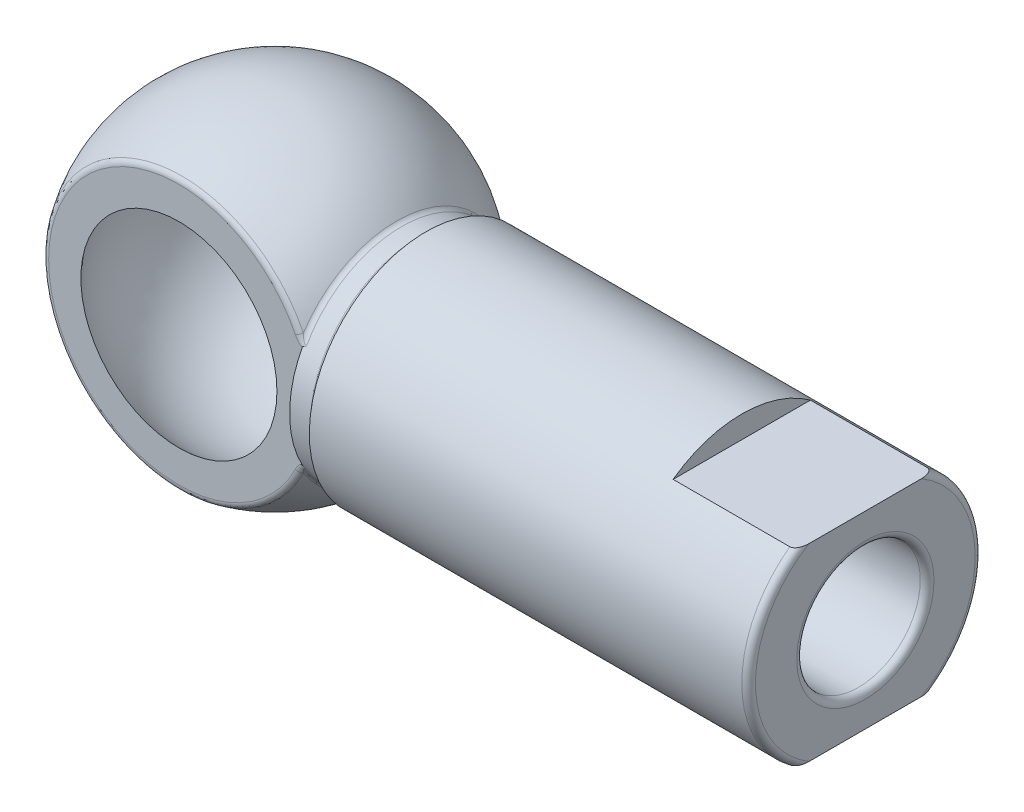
SolidWorks part; units mm, degrees
ref_plane "Plan de face" through (0, 0, 0) normal (0, 0, 1) x (1, 0, 0)
ref_plane "Plan de dessus" through (0, 0, 0) normal (0, 1, 0) x (1, 0, 0)
ref_plane "Plan de droite" through (0, 0, 0) normal (1, 0, 0) x (0, 0, -1)
sketch "Esquisse1" plane through (0, 0, 0) normal (0, 0, 1) x (1, 0, 0)
  line L0 (0, 0) -> (0, 12)
  line L1 (0, -55) -> (0, 55) construction
  arc A0 (0, 12) -> (0, 0) centre (0, 6) cw
  dimension "D1" = 12
revolve "Révolution1" add sketch "Esquisse1" angle 360 about L0
ref_plane "Plan1" through (0, 0, 3.5) normal (0, 0, 1) x (1, 0, 0)
sketch "Esquisse2" plane through (0, 0, 3.5) normal (0, 0, 1) x (1, 0, 0)
  circle A0 centre (0, 6) radius 5
  circle A1 centre (0, 6) radius 6 construction
  dimension "D1" = 10
extrude "Enlèv. mat.-Extru.1" cut sketch "Esquisse2" along normal through all
shell "Coque1" thickness 1
ref_plane "Plan2" through (4.5, 0, 0) normal (1, 0, 0) x (0, 0, -1)
sketch "Esquisse3" plane through (4.5, 0, 0) normal (1, 0, 0) x (0, 0, -1)
  circle A0 centre (0, 6) radius 4
  arc A1 (-3.5, 1.1266) -> (-3.5, 10.8734) centre (0, 6) ccw construction
  dimension "D1" = 8
extrude "Enlèv. mat.-Extru.2" cut sketch "Esquisse3" along normal through all
sketch "Esquisse4" plane through (4.5, 0, 0) normal (1, 0, 0) x (0, 0, -1)
  circle A0 centre (0, 6) radius 3.9686
  arc A1 (-3.5, 4.1292) -> (-3.5, 7.8708) centre (0, 6) ccw construction
extrude "Extrusion1" add sketch "Esquisse4" along normal blind 1
sketch "Esquisse5" plane through (5.5, 0, 0) normal (1, 0, 0) x (0, 0, -1)
  circle A0 centre (0, 6) radius 4.25
  circle A1 centre (0, 6) radius 3.9686 construction
  dimension "D1" = 8.5
extrude "Extrusion2" add sketch "Esquisse5" along normal blind 16
sketch "Esquisse6" plane through (21.5, 0, 0) normal (1, 0, 0) x (0, 0, -1)
  circle A0 centre (0, 6) radius 2.25
  circle A1 centre (0, 6) radius 4.25 construction
  dimension "D1" = 4.5
extrude "Enlèv. mat.-Extru.3" cut sketch "Esquisse6" against normal up to next
sketch "Esquisse7" plane through (21.5, 0, 0) normal (1, 0, 0) x (0, 0, -1)
  line L0 (-2.5, 9.4369) -> (2.5, 9.4369)
  line L1 (2.5, 2.5631) -> (-2.5, 2.5631)
  circle A0 centre (0, 6) radius 4.25 construction
  arc A1 (2.5, 9.4369) -> (-2.5, 9.4369) centre (0, 6) ccw
  arc A2 (2.5, 2.5631) -> (-2.5, 2.5631) centre (0, 6) cw
  dimension "D1" = 5
extrude "Enlèv. mat.-Extru.4" cut sketch "Esquisse7" against normal blind 4.5
fillet "Congé2" radius 0.25 2 edges at (4.5, 6, -3.9686) (5.5, 6, -3.9686)
fillet "Congé3" radius 0.25 8 edges at (21.5, 6, -2.25) (21.5, 6, 4.25) (21.5, 6, -4.25) (-4.8734, 6, 3.5) (4.5557, 7.8708, 3.5) (4.5557, 4.1292, 3.5) (4.5371, 4.1053, 3.5) (4.5227, 7.9051, 3.5)
